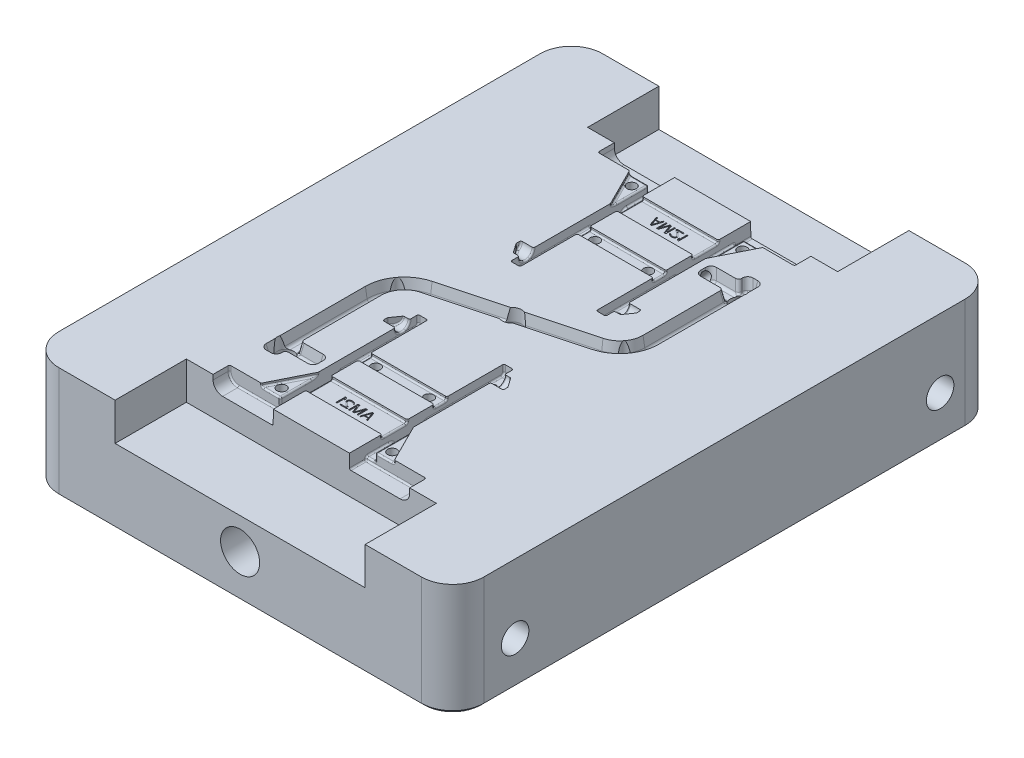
SolidWorks part; units mm, degrees
ref_plane "Plan de face" through (0, 0, 0) normal (0, 0, 1) x (1, 0, 0)
ref_plane "Plan de dessus" through (0, 0, 0) normal (0, 1, 0) x (1, 0, 0)
ref_plane "Plan de droite" through (0, 0, 0) normal (1, 0, 0) x (0, 0, -1)
imported_body "Importée1"
fillet "Congé1" radius 0.5
fillet "Congé2" radius 0.5 113 edges at (12.1889, -1.0194, 50.2336) (-15.2161, -1.0194, 50.2336) (15.2161, -1.0194, 50.2336) (12.204, -2.7508, 49.9243) (-15.201, -2.7508, 49.9243) (-12.1889, -1.0194, 50.2336) (15.201, -2.7508, 49.9243) (12.2066, -3.045, 37.2924) (-15.1984, -3.045, 37.2924) (-12.204, -2.7508, 49.9243) (15.1984, -3.045, 37.2924) (-12.2066, -3.045, 37.2924) (15.1721, -6.0637, 23.2921) (15.1497, -8.6275, 19.285) (15.1548, -8.0392, 15.8835) (15.1719, -6.09, 15.2781) (15.1889, -4.1408, 14.6728) (12.2329, -6.0637, 23.2921) (12.2553, -8.6275, 19.285) (12.2502, -8.0392, 15.8835) (12.2331, -6.09, 15.2781) (12.2161, -4.1408, 14.6728) (-31.4582, -0.7745, 6.0832) (-30.5503, -3.685, 6.0578) (-15.1721, -6.0637, 23.2921) (-15.1548, -8.0392, 22.6865) (-15.1497, -8.6275, 19.285) (-15.1548, -8.0392, 15.8835) (-15.1719, -6.09, 15.2781) (-15.1889, -4.1408, 14.6728) (-12.2502, -8.0392, 22.6865) (-12.2553, -8.6275, 19.285) (-12.2502, -8.0392, 15.8835) (-12.2331, -6.09, 15.2781) (-12.2161, -4.1408, 14.6728) (18.2628, -1.015, 123.9189) (18.2628, -1.015, 117.8255) (15.2206, -0.5075, 111.731) (15.2161, -1.015, 117.8255) (15.2051, -2.2838, 123.9299) (13.7025, -3.5525, 123.941) (12.2154, -4.06, 123.9454) (12.2199, -4.5675, 3.4278) (15.194, -3.5525, 9.6513) (15.2161, -1.015, 12.1745) (15.2206, -0.5075, 18.269) (18.2628, -1.015, 12.1745) (21.3123, -0.5075, 6.0856) (18.2628, -1.015, 6.0811) (13.7025, -3.5525, 6.059) (12.211, -3.5525, 9.6513) (-20.3132, -4.5675, 6.0501) (-18.2628, -1.015, 12.1745) (-15.2206, -0.5075, 18.269) (-15.2161, -1.015, 12.1745) (-15.2051, -2.2838, 6.0701) (-15.194, -3.5525, 9.6513) (-13.7025, -3.5525, 6.059) (-12.211, -3.5525, 9.6513) (-12.2154, -4.06, 6.0546) (-12.2199, -4.5675, 3.4278)
fillet "Congé3" radius 0.5 12 edges at (12.0402, -1.015, 32.1123) (-12.0402, -1.015, 32.1123) (12.0402, -1.015, 27.7727) (0, -1.015, 31.9636)
fillet "Congé4" radius 0.5 12 edges
fillet "Congé5" radius 0.5 11 edges at (12.1885, -0.9708, 118.7202) (-15.2051, -2.2837, 45.1675)
